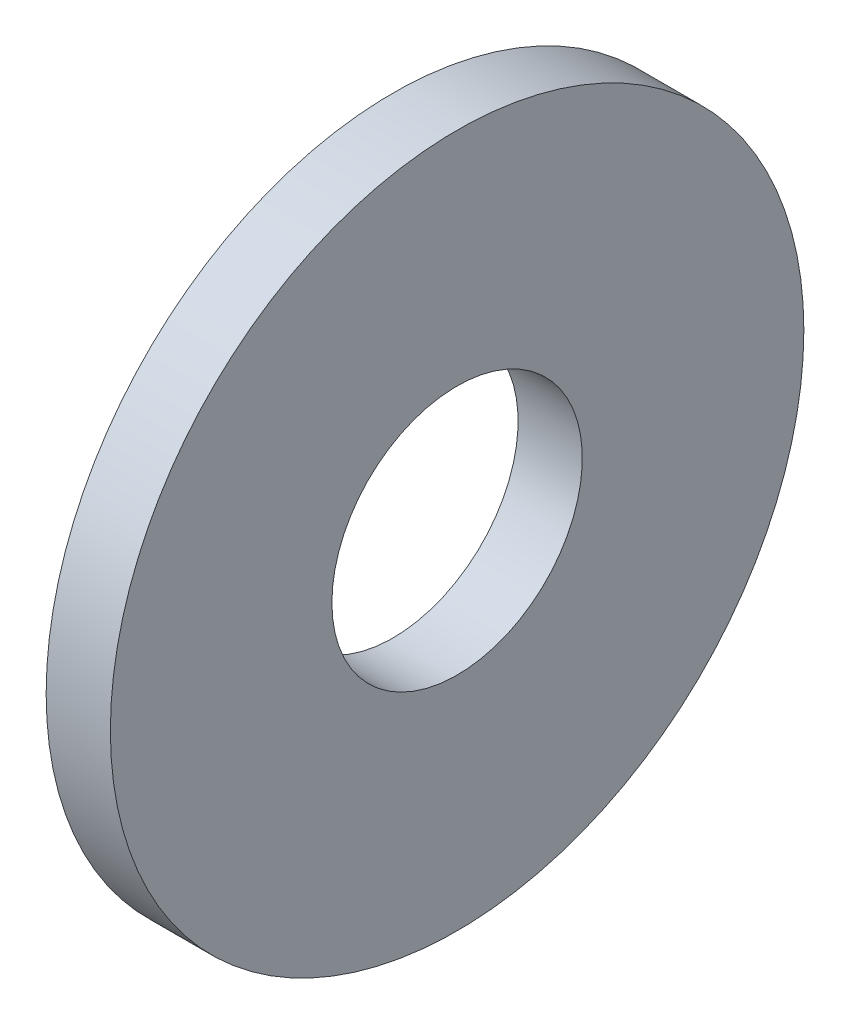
SolidWorks part; units mm, degrees
ref_plane "Plane1" through (0, 0, 0) normal (0, 0, 1) x (1, 0, 0)
ref_plane "Plane2" through (0, 0, 0) normal (0, 1, 0) x (1, 0, 0)
ref_plane "Plane3" through (0, 0, 0) normal (1, 0, 0) x (0, 0, -1)
other "Configuration Table"
sketch "Sketch1" plane through (0, 0, 0) normal (0, 0, 1) x (1, 0, 0)
  line L0 (-34.925, 0) -> (9.525, 0) construction
  line L1 (0, 19.5) -> (0, 54)
  line L2 (0, 54) -> (-10, 54)
  line L3 (-10, 54) -> (-10, 19.5)
  line L4 (-10, 19.5) -> (0, 19.5)
  dimension "Thickness" = 10
  dimension "Inside_dia" = 39
  dimension "Outside_dia" = 108
revolve "Base-Revolve" add sketch "Sketch1" angle 360 about L0
